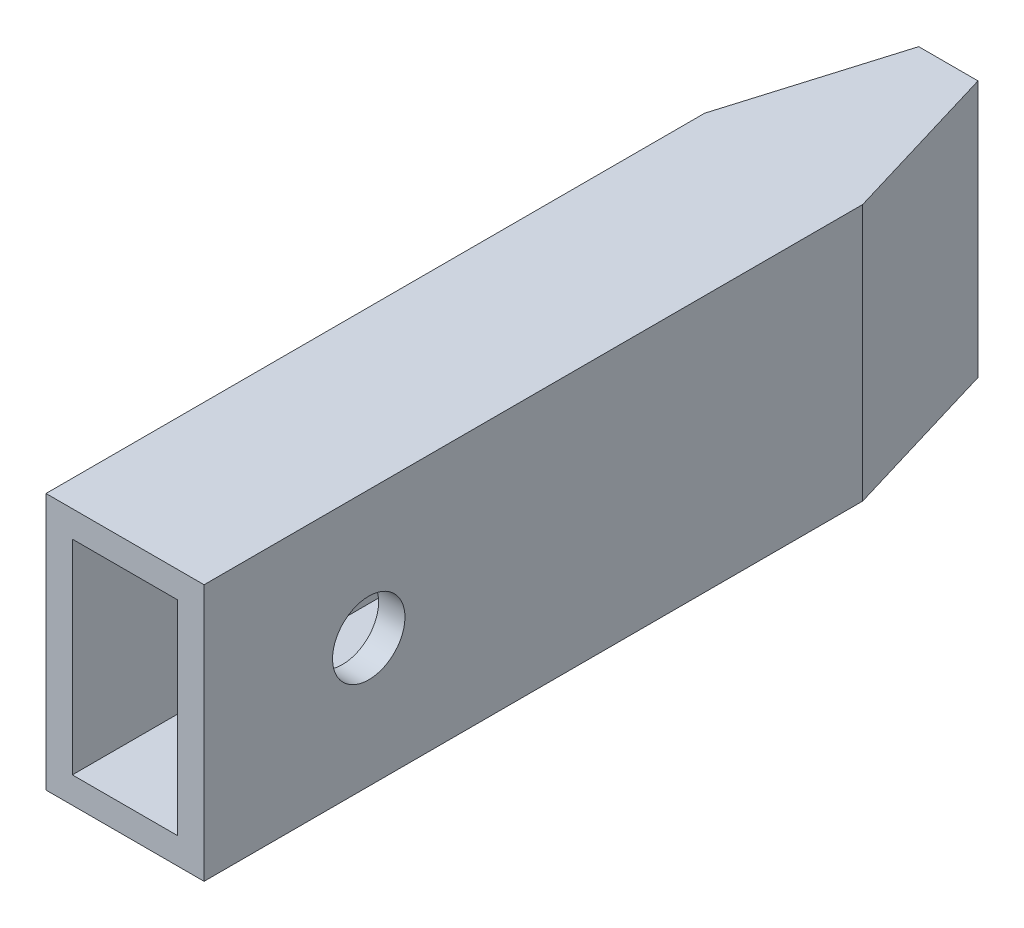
SolidWorks part; units mm, degrees
ref_plane "Front Plane" through (0, 0, 0) normal (0, 0, 1) x (1, 0, 0)
ref_plane "Top Plane" through (0, 0, 0) normal (0, 1, 0) x (1, 0, 0)
ref_plane "Right Plane" through (0, 0, 0) normal (1, 0, 0) x (0, 0, -1)
sketch "Sketch1" plane through (0, 0, 0) normal (0, 0, 1) x (1, 0, 0)
  line L4 (-1.6, -3.1) -> (1.6, -3.1)
  line L5 (1.6, -3.1) -> (1.6, 3.1)
  line L6 (-1.6, 3.1) -> (1.6, 3.1)
  line L7 (-1.6, -3.1) -> (-1.6, 3.1)
  line L8 (-2.4, -3.9) -> (2.4, -3.9)
  line L9 (2.4, -3.9) -> (2.4, 3.9)
  line L10 (-2.4, 3.9) -> (2.4, 3.9)
  line L11 (-2.4, -3.9) -> (-2.4, 3.9)
  dimension "D1" = 0.8
extrude "Boss-Extrude1" add sketch "Sketch1" along normal blind 20
sketch "Sketch2" plane through (0, 0, 0) normal (0, 0, -1) x (-1, 0, 0)
  line L1 (-2.4, 3.9) -> (2.4, 3.9)
  line L2 (-2.4, 3.9) -> (-2.4, -3.9)
  line L3 (-2.4, -3.9) -> (2.4, -3.9)
  line L4 (2.4, 3.9) -> (2.4, -3.9)
extrude "Boss-Extrude2" add sketch "Sketch2" along normal blind 5
chamfer "Chamfer1" distance 5 distance2 1.5 2 edges at (-2.4, 0, -5) (2.4, 0, -5)
sketch "Sketch3" plane through (2.4, 0, 0) normal (1, 0, 0) x (0, 0, -1)
  circle A0 centre (-15, 0) radius 1.1
extrude "Cut-Extrude1" cut sketch "Sketch3" against normal blind 5
